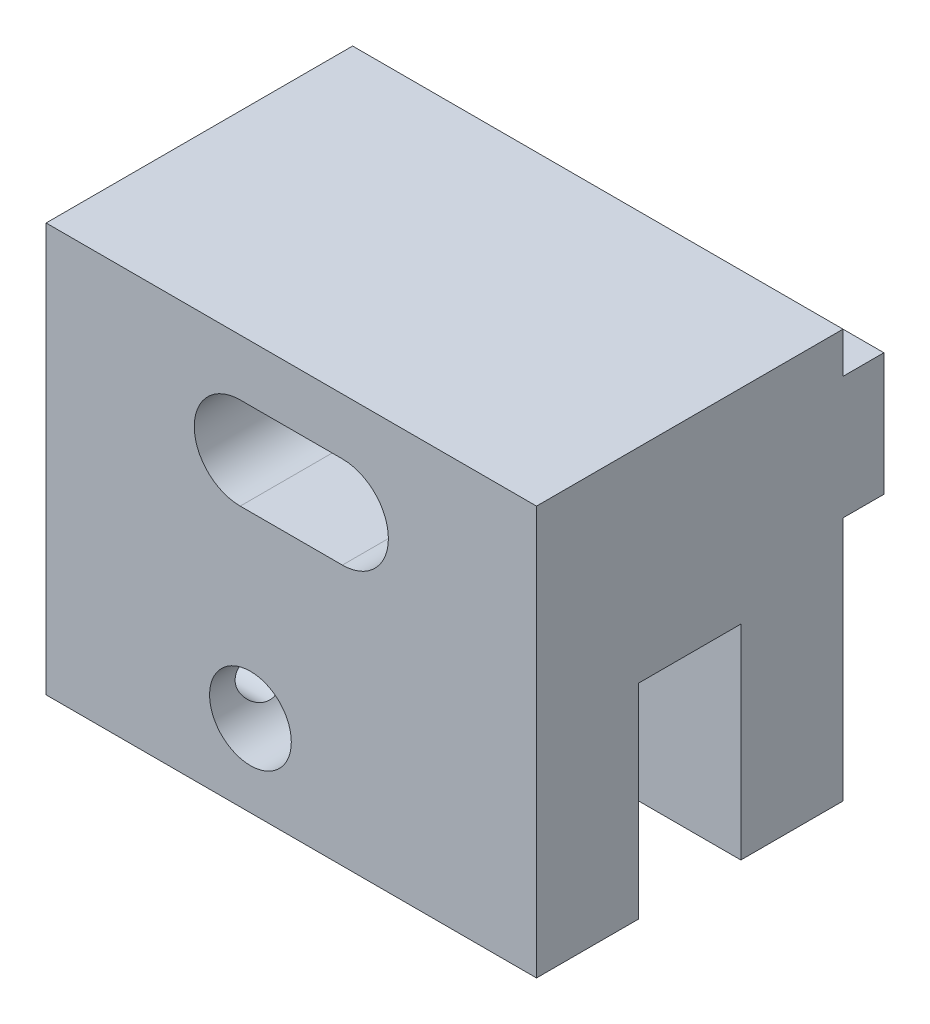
SolidWorks part; units mm, degrees
ref_plane "前视基准面" through (0, 0, 0) normal (0, 0, 1) x (1, 0, 0)
ref_plane "上视基准面" through (0, 0, 0) normal (0, 1, 0) x (1, 0, 0)
ref_plane "右视基准面" through (0, 0, 0) normal (1, 0, 0) x (0, 0, -1)
sketch "草图1" plane through (0, 0, 0) normal (0, 0, 1) x (1, 0, 0)
  line L0 (0, 0) -> (24, 0)
  line L1 (0, 20) -> (24, 20)
  line L2 (0, 0) -> (0, 20)
  line L3 (24, 0) -> (24, 20)
  line L4 (9.5, 12.75) -> (14.5, 12.75)
  line L5 (14.5, 17.25) -> (9.5, 17.25)
  circle A0 centre (10, 4) radius 2
  arc A1 (14.5, 12.75) -> (14.5, 17.25) centre (14.5, 15) ccw
  arc A2 (9.5, 17.25) -> (9.5, 12.75) centre (9.5, 15) ccw
extrude "凸台-拉伸1" add sketch "草图1" along normal blind 17
sketch "草图3" plane through (24, 0, 0) normal (1, 0, 0) x (0, 0, -1)
  line L0 (-12, 0) -> (-12, 10)
  line L1 (-17, 0) -> (-17, 20)
  line L2 (-17, 0) -> (-12, 0)
  line L3 (-12, 10) -> (-7, 10)
  line L4 (-17, 20) -> (-2, 20)
  line L5 (-7, 0) -> (-7, 10)
  line L6 (-2, 0) -> (-2, 12)
  line L7 (0, 12) -> (0, 18)
  line L8 (-7, 0) -> (-2, 0)
  line L9 (-2, 12) -> (0, 12)
  line L10 (-2, 18) -> (0, 18)
  line L11 (-2, 18) -> (-2, 20)
extrude "切除-拉伸1" cut sketch "草图3" against normal through all flip side to cut
sketch "草图4" plane through (24, 0, 0) normal (1, 0, 0) x (0, 0, -1)
  circle A0 centre (-4.5, 4) radius 1.25
  circle A1 centre (-14.5, 4) radius 1.25
sketch "草图5" plane through (0, 0, 0) normal (-1, 0, 0) x (0, 0, 1)
  circle A0 centre (4.5, 4) radius 1.25
  circle A1 centre (14.5, 4) radius 1.25
extrude "切除-拉伸2" cut sketch "草图5" against normal up to next
sketch "草图6" plane through (0, 20, 0) normal (0, 1, 0) x (1, 0, 0)
  circle A0 centre (20, -9.5) radius 1.75 construction
sketch "草图7" plane through (0, 10, 0) normal (0, -1, 0) x (1, 0, 0)
  circle A0 centre (20, 9.5) radius 1.75
extrude "切除-拉伸3" cut sketch "草图7" against normal blind 4
